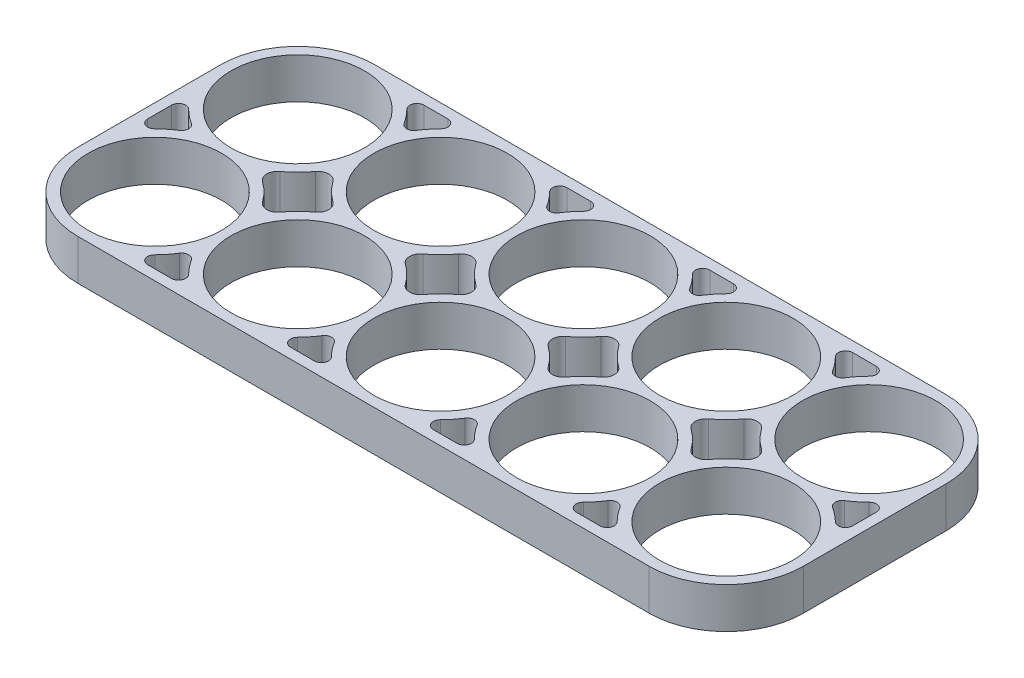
SolidWorks part; units mm, degrees
ref_plane "Ebene vorne" through (0, 0, 0) normal (0, 0, 1) x (1, 0, 0)
ref_plane "Ebene oben" through (0, 0, 0) normal (0, 1, 0) x (1, 0, 0)
ref_plane "Ebene rechts" through (0, 0, 0) normal (1, 0, 0) x (0, 0, -1)
sketch "Skizze1" plane through (0, 0, 0) normal (0, 1, 0) x (1, 0, 0)
  line L0 (0, -50) -> (0, 50) construction
  line L1 (-50, 0) -> (50, 0) construction
  line L2 (-50.8, 10) -> (-50.8, -10)
  line L3 (-40, 20.8) -> (40, 20.8)
  line L4 (-49.35, 1.6623) -> (-49.35, -1.6623)
  line L5 (-31.6623, 19.35) -> (-28.3377, 19.35)
  line L6 (-40, -20.8) -> (40, -20.8)
  line L7 (-31.6623, -19.35) -> (-28.3377, -19.35)
  line L8 (50.8, 10) -> (50.8, -10)
  line L9 (49.35, 1.6623) -> (49.35, -1.6623)
  line L10 (-11.6623, -19.35) -> (-8.3377, -19.35)
  line L11 (8.3377, -19.35) -> (11.6623, -19.35)
  line L12 (28.3377, -19.35) -> (31.6623, -19.35)
  line L13 (-11.6623, 19.35) -> (-8.3377, 19.35)
  line L14 (8.3377, 19.35) -> (11.6623, 19.35)
  line L15 (28.3377, 19.35) -> (31.6623, 19.35)
  circle A0 centre (-40, 10) radius 9.35
  circle A1 centre (-20, 10) radius 9.35
  circle A2 centre (0, 10) radius 9.35
  circle A3 centre (20, 10) radius 9.35
  circle A4 centre (40, 10) radius 9.35
  circle A5 centre (40, -10) radius 9.35
  circle A6 centre (20, -10) radius 9.35
  circle A7 centre (0, -10) radius 9.35
  circle A8 centre (-20, -10) radius 9.35
  circle A9 centre (-40, -10) radius 9.35
  arc A10 (-33.7117, 1.2195) -> (-31.2195, 3.7117) centre (-40, 10) ccw
  arc A11 (-13.7117, 1.2195) -> (-11.2195, 3.7117) centre (-20, 10) ccw
  arc A12 (6.2883, 1.2195) -> (8.7805, 3.7117) centre (0, 10) ccw
  arc A13 (26.2883, 1.2195) -> (28.7805, 3.7117) centre (20, 10) ccw
  arc A15 (-45.7333, -0.8475) -> (-47.6424, -2.3689) centre (-40, -10) ccw
  arc A16 (-26.2883, -1.2195) -> (-28.7805, -3.7117) centre (-20, -10) ccw
  arc A17 (-6.2883, -1.2195) -> (-8.7805, -3.7117) centre (0, -10) ccw
  arc A18 (13.7117, -1.2195) -> (11.2195, -3.7117) centre (20, -10) ccw
  arc A19 (33.7117, -1.2195) -> (31.2195, -3.7117) centre (40, -10) ccw
  arc A20 (45.7333, 0.8475) -> (47.6424, 2.3689) centre (40, 10) ccw
  arc A21 (-28.7805, 3.7117) -> (-26.2883, 1.2195) centre (-20, 10) ccw
  arc A22 (-30.8475, 15.7333) -> (-32.3689, 17.6424) centre (-40, 10) ccw
  arc A23 (-10.8475, 15.7333) -> (-12.3689, 17.6424) centre (-20, 10) ccw
  arc A24 (-8.7805, 3.7117) -> (-6.2883, 1.2195) centre (0, 10) ccw
  arc A25 (-11.2195, -3.7117) -> (-13.7117, -1.2195) centre (-20, -10) ccw
  arc A26 (-9.1525, -15.7333) -> (-7.6311, -17.6424) centre (0, -10) ccw
  arc A27 (-29.1525, -15.7333) -> (-27.6311, -17.6424) centre (-20, -10) ccw
  arc A28 (-31.2195, -3.7117) -> (-33.7117, -1.2195) centre (-40, -10) ccw
  arc A29 (8.7805, -3.7117) -> (6.2883, -1.2195) centre (0, -10) ccw
  arc A30 (10.8475, -15.7333) -> (12.3689, -17.6424) centre (20, -10) ccw
  arc A31 (9.1525, 15.7333) -> (7.6311, 17.6424) centre (0, 10) ccw
  arc A32 (11.2195, 3.7117) -> (13.7117, 1.2195) centre (20, 10) ccw
  arc A33 (29.1525, 15.7333) -> (27.6311, 17.6424) centre (20, 10) ccw
  arc A34 (31.2195, 3.7117) -> (33.7117, 1.2195) centre (40, 10) ccw
  arc A35 (28.7805, -3.7117) -> (26.2883, -1.2195) centre (20, -10) ccw
  arc A36 (30.8475, -15.7333) -> (32.3689, -17.6424) centre (40, -10) ccw
  arc A37 (-32.3689, -17.6424) -> (-30.8475, -15.7333) centre (-40, -10) ccw
  arc A38 (-12.3689, -17.6424) -> (-10.8475, -15.7333) centre (-20, -10) ccw
  arc A39 (7.6311, -17.6424) -> (9.1525, -15.7333) centre (0, -10) ccw
  arc A40 (27.6311, -17.6424) -> (29.1525, -15.7333) centre (20, -10) ccw
  arc A41 (40, -20.8) -> (50.8, -10) centre (40, -10) ccw
  arc A42 (50.8, 10) -> (40, 20.8) centre (40, 10) ccw
  arc A43 (47.6424, -2.3689) -> (45.7333, -0.8475) centre (40, -10) ccw
  arc A44 (-50.8, -10) -> (-40, -20.8) centre (-40, -10) ccw
  arc A45 (-47.6424, 2.3689) -> (-45.7333, 0.8475) centre (-40, 10) ccw
  arc A46 (-40, 20.8) -> (-50.8, 10) centre (-40, 10) ccw
  arc A47 (-27.6311, 17.6424) -> (-29.1525, 15.7333) centre (-20, 10) ccw
  arc A48 (-7.6311, 17.6424) -> (-9.1525, 15.7333) centre (0, 10) ccw
  arc A49 (12.3689, 17.6424) -> (10.8475, 15.7333) centre (20, 10) ccw
  arc A50 (32.3689, 17.6424) -> (30.8475, 15.7333) centre (40, 10) ccw
  arc A51 (45.7333, -0.8475) -> (45.7333, 0.8475) centre (46.2642, 0) cw
  arc A52 (47.6424, -2.3689) -> (49.35, -1.6623) centre (48.35, -1.6623) ccw
  arc A53 (49.35, 1.6623) -> (47.6424, 2.3689) centre (48.35, 1.6623) ccw
  arc A54 (-49.35, -1.6623) -> (-47.6424, -2.3689) centre (-48.35, -1.6623) ccw
  arc A55 (-47.6424, 2.3689) -> (-49.35, 1.6623) centre (-48.35, 1.6623) ccw
  arc A56 (-45.7333, -0.8475) -> (-45.7333, 0.8475) centre (-46.2642, 0) ccw
  arc A57 (-8.3377, -19.35) -> (-7.6311, -17.6424) centre (-8.3377, -18.35) ccw
  arc A58 (-9.1525, -15.7333) -> (-10.8475, -15.7333) centre (-10, -16.2642) ccw
  arc A59 (-29.1525, -15.7333) -> (-30.8475, -15.7333) centre (-30, -16.2642) ccw
  arc A60 (-28.3377, -19.35) -> (-27.6311, -17.6424) centre (-28.3377, -18.35) ccw
  arc A61 (-31.6623, -19.35) -> (-32.3689, -17.6424) centre (-31.6623, -18.35) cw
  arc A62 (-11.6623, -19.35) -> (-12.3689, -17.6424) centre (-11.6623, -18.35) cw
  arc A63 (28.3377, -19.35) -> (27.6311, -17.6424) centre (28.3377, -18.35) cw
  arc A64 (8.3377, -19.35) -> (7.6311, -17.6424) centre (8.3377, -18.35) cw
  arc A65 (31.6623, -19.35) -> (32.3689, -17.6424) centre (31.6623, -18.35) ccw
  arc A66 (11.6623, -19.35) -> (12.3689, -17.6424) centre (11.6623, -18.35) ccw
  arc A67 (9.1525, -15.7333) -> (10.8475, -15.7333) centre (10, -16.2642) cw
  arc A68 (29.1525, -15.7333) -> (30.8475, -15.7333) centre (30, -16.2642) cw
  arc A69 (29.1525, 15.7333) -> (30.8475, 15.7333) centre (30, 16.2642) ccw
  arc A70 (32.3689, 17.6424) -> (31.6623, 19.35) centre (31.6623, 18.35) ccw
  arc A71 (27.6311, 17.6424) -> (28.3377, 19.35) centre (28.3377, 18.35) cw
  arc A72 (9.1525, 15.7333) -> (10.8475, 15.7333) centre (10, 16.2642) ccw
  arc A73 (12.3689, 17.6424) -> (11.6623, 19.35) centre (11.6623, 18.35) ccw
  arc A74 (7.6311, 17.6424) -> (8.3377, 19.35) centre (8.3377, 18.35) cw
  arc A75 (-10.8475, 15.7333) -> (-9.1525, 15.7333) centre (-10, 16.2642) ccw
  arc A76 (-7.6311, 17.6424) -> (-8.3377, 19.35) centre (-8.3377, 18.35) ccw
  arc A77 (-12.3689, 17.6424) -> (-11.6623, 19.35) centre (-11.6623, 18.35) cw
  arc A78 (-30.8475, 15.7333) -> (-29.1525, 15.7333) centre (-30, 16.2642) ccw
  arc A79 (-27.6311, 17.6424) -> (-28.3377, 19.35) centre (-28.3377, 18.35) ccw
  arc A80 (-31.6623, 19.35) -> (-32.3689, 17.6424) centre (-31.6623, 18.35) ccw
  arc A81 (28.7805, -3.7117) -> (31.2195, -3.7117) centre (30, -2.8383) ccw
  arc A82 (33.7117, -1.2195) -> (33.7117, 1.2195) centre (32.8383, 0) ccw
  arc A83 (31.2195, 3.7117) -> (28.7805, 3.7117) centre (30, 2.8383) ccw
  arc A84 (26.2883, -1.2195) -> (26.2883, 1.2195) centre (27.1617, 0) cw
  arc A85 (8.7805, -3.7117) -> (11.2195, -3.7117) centre (10, -2.8383) ccw
  arc A86 (13.7117, -1.2195) -> (13.7117, 1.2195) centre (12.8383, 0) ccw
  arc A87 (8.7805, 3.7117) -> (11.2195, 3.7117) centre (10, 2.8383) cw
  arc A88 (-6.2883, -1.2195) -> (-6.2883, 1.2195) centre (-7.1617, 0) ccw
  arc A89 (-8.7805, -3.7117) -> (-11.2195, -3.7117) centre (-10, -2.8383) cw
  arc A90 (6.2883, -1.2195) -> (6.2883, 1.2195) centre (7.1617, 0) cw
  arc A91 (-31.2195, -3.7117) -> (-28.7805, -3.7117) centre (-30, -2.8383) ccw
  arc A92 (-26.2883, -1.2195) -> (-26.2883, 1.2195) centre (-27.1617, 0) ccw
  arc A93 (-33.7117, -1.2195) -> (-33.7117, 1.2195) centre (-32.8383, 0) cw
  arc A94 (-13.7117, -1.2195) -> (-13.7117, 1.2195) centre (-12.8383, 0) cw
  arc A95 (-8.7805, 3.7117) -> (-11.2195, 3.7117) centre (-10, 2.8383) ccw
  arc A96 (-28.7805, 3.7117) -> (-31.2195, 3.7117) centre (-30, 2.8383) ccw
  point P88 (-49.35, 4.5947)
  point P91 (-44.0792, 0)
  point P102 (-34.5947, -19.35)
  point P109 (5.4053, -19.35)
  point P124 (25.4053, 19.35)
  dimension "D1" = 18.7
  dimension "D2" = 21.6
  dimension "D8" = 1
  dimension "D9" = 1.5
  dimension "D3" = 20
  dimension "D4" = 20
  dimension "D5" = 20
  dimension "D6" = 20
  dimension "D7" = 20
extrude "Aufsatz-Linear austragen1" add sketch "Skizze1" along normal blind 5.7
